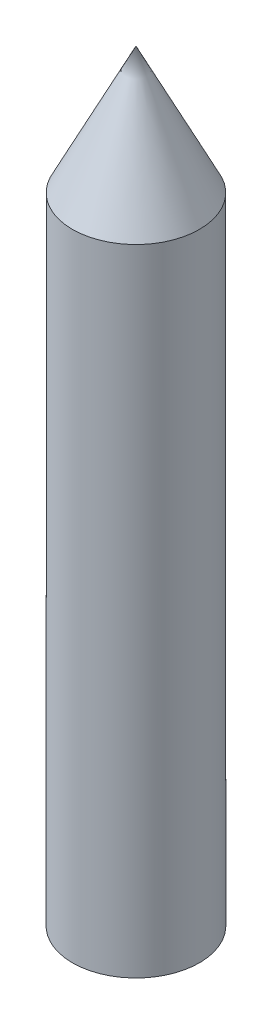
SolidWorks part; units mm, degrees
ref_plane "Front Plane" through (0, 0, 0) normal (0, 0, 1) x (1, 0, 0)
ref_plane "Top Plane" through (0, 0, 0) normal (0, 1, 0) x (1, 0, 0)
ref_plane "Right Plane" through (0, 0, 0) normal (1, 0, 0) x (0, 0, -1)
sketch "Sketch1" plane through (0, 0, 0) normal (0, 1, 0) x (1, 0, 0)
  circle A0 centre (0, 0) radius 5
  dimension "D1" = 10
extrude "Boss-Extrude1" add sketch "Sketch1" along normal blind 50
sketch "Sketch2" plane through (0, 50, 0) normal (0, 1, 0) x (1, 0, 0)
  line L0 (-5, 0) -> (5, 0) construction
  circle A0 centre (0, 0) radius 5 construction
  point P6 (0, 0)
sketch "Sketch3" plane through (0, 0, 0) normal (1, 0, 0) x (0, 0, -1)
  line L0 (0, 50) -> (0, 60)
  line L1 (5, 50) -> (-5, 50) construction
  line L2 (0, 60) -> (5, 50)
  line L3 (5, 50) -> (0, 50)
  point P6 (4.7827, 50)
  point P9 (5, 50)
  dimension "D1" = 10
revolve "Revolve1" add sketch "Sketch3" angle 360 about L0
